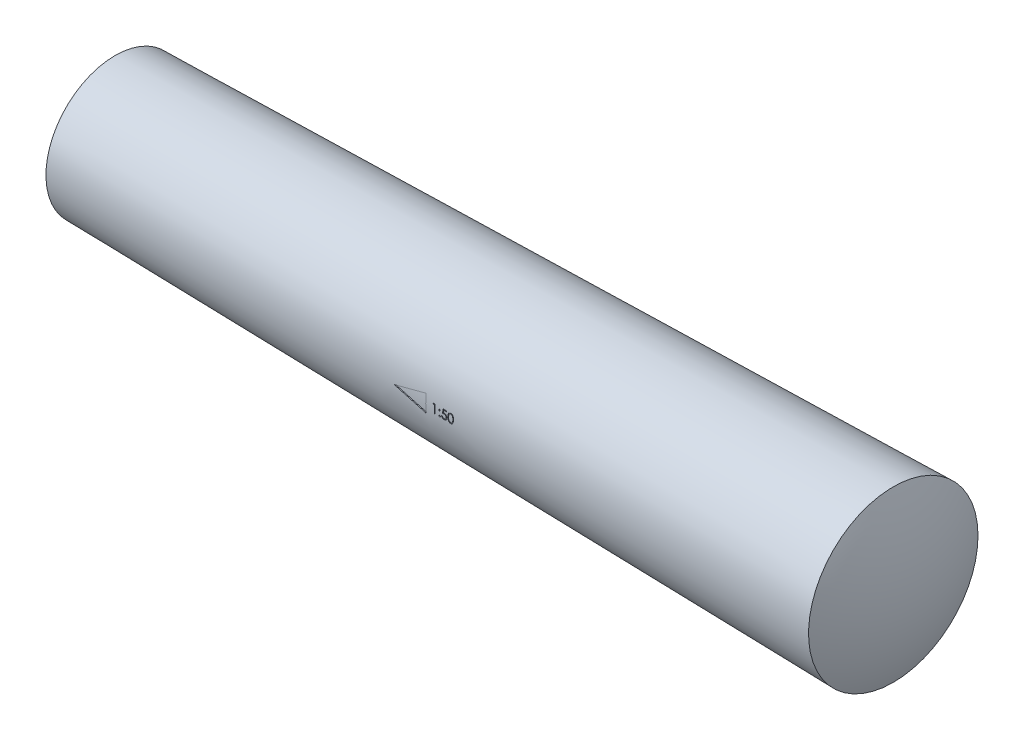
SolidWorks part; units mm, degrees
ref_plane "Front Plane" through (0, 0, 0) normal (0, 0, 1) x (1, 0, 0)
ref_plane "Top Plane" through (0, 0, 0) normal (0, 1, 0) x (1, 0, 0)
ref_plane "Right Plane" through (0, 0, 0) normal (1, 0, 0) x (0, 0, -1)
sketch "Sketch1" plane through (0, 0, 0) normal (1, 0, 0) x (0, 0, -1)
  circle A0 centre (0, 0) radius 8
  dimension "D1" = 16
extrude "Extrude1" add sketch "Sketch1" along normal mid plane 90
draft "Draft1" type of draft neutral plane draft angle 1.146 faces to draft 1 parameters "D1"=1.146
sketch "Sketch2" plane through (0, 0, 0) normal (0, 0, 1) x (1, 0, 0)
  line L0 (-45, 0) -> (-45, 8)
  line L1 (-45, 8) -> (-45, -8) construction
  line L2 (-45, 0) -> (-47, 0)
  line L3 (-47, 0) -> (-47, -8.9) construction
  line L4 (45, 0) -> (45, 9.8001)
  line L5 (45, -9.8001) -> (45, 9.8001) construction
  line L6 (45, 0) -> (47, 0)
  line L7 (47, 0) -> (47, -8.9) construction
  line L8 (-45, -8) -> (45, -9.8001) construction
  arc A0 (-47, 0) -> (-45, 8) centre (-30, 0) cw
  arc A1 (47, 0) -> (45, 9.8001) centre (21.9897, 0) ccw
  point P14 (0, -8.9)
revolve "Revolve1" add sketch "Sketch2" angle 360 about L2
sketch "Sketch5" plane through (0, 0, 0) normal (0, 0, 1) x (1, 0, 0)
  line L0 (0, 8.9) -> (0, -8.9) construction
  line L1 (45, 9.8001) -> (-45, 8) construction
  line L2 (-45, -8) -> (45, -9.8001) construction
ref_plane "Plane2" through (0, 0, 0) normal (-0.02, 0, 0.9998) x (0.9998, 0, 0.02)
sketch "Sketch6" plane through (0, 0, 0) normal (-0.02, 0, 0.9998) x (0.9998, 0, 0.02)
  line L0 (0, 0) -> (0, 1)
  line L1 (0, 8.9) -> (0, -8.9) construction
  line L2 (0, 1) -> (-3.7321, 0)
  line L3 (-3.7321, 0) -> (0, -1)
  line L4 (0, -1) -> (0, 0)
  line L5 (0, -0.5) -> (4, -0.5) construction
  text T0 "1:50" font "Century Gothic" height 1
  dimension "D1" = 2
  dimension "D2" = 30
  dimension "D3" = 4
wrap "Wrap2" sketch "Sketch6" wrap type deboss source sketch "Sketch6" thickness 0.1 parameters "D1"=0.1
equation "\"D2@Sketch2\" = \"D1@Sketch2\""
